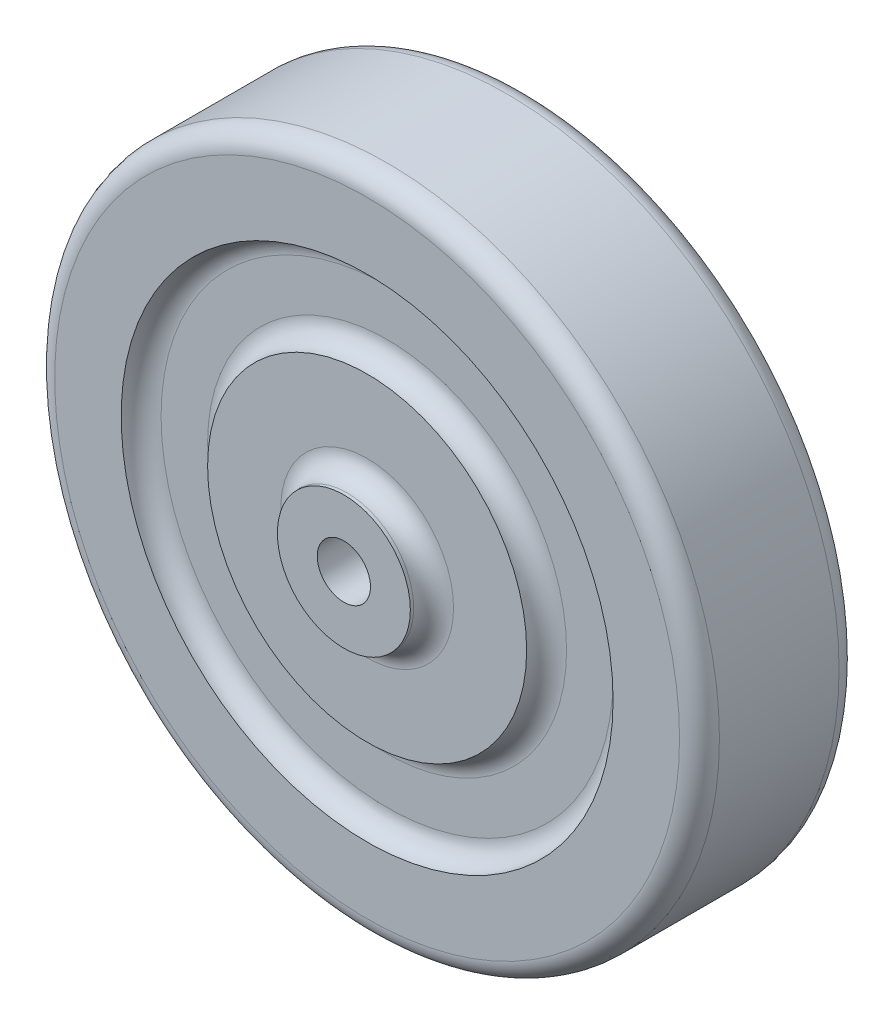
SolidWorks part; units mm, degrees
ref_plane "正面" through (0, 0, 0) normal (0, 0, 1) x (1, 0, 0)
ref_plane "平面" through (0, 0, 0) normal (0, 1, 0) x (1, 0, 0)
ref_plane "右側面" through (0, 0, 0) normal (1, 0, 0) x (0, 0, -1)
sketch "ｽｹｯﾁ2" plane through (0, 0, 0) normal (0, 0, 1) x (1, 0, 0)
  circle A0 centre (0, 0) radius 50
  dimension "D1" = 100
extrude "押し出し1" add sketch "ｽｹｯﾁ2" along normal mid plane 24
sketch "ｽｹｯﾁ4" plane through (0, 0, 12) normal (0, 0, 1) x (1, 0, 0)
  circle A0 centre (0, 0) radius 10
  dimension "D1" = 20
extrude "押し出し2" add sketch "ｽｹｯﾁ4" along normal blind 3.5
sketch "ｽｹｯﾁ5" plane through (0, 0, -12) normal (0, 0, -1) x (-1, 0, 0)
  circle A0 centre (0, 0) radius 10
  dimension "D1" = 20
extrude "押し出し3" add sketch "ｽｹｯﾁ5" along normal blind 3.5
sketch "ｽｹｯﾁ6" plane through (0, 0, 15.5) normal (0, 0, 1) x (1, 0, 0)
  circle A0 centre (0, 0) radius 4
  dimension "D1" = 8
extrude "押し出し4" cut sketch "ｽｹｯﾁ6" against normal through all
sketch "ｽｹｯﾁ7" plane through (0, 0, 12) normal (0, 0, 1) x (1, 0, 0)
  circle A0 centre (0, 0) radius 24
  circle A1 centre (0, 0) radius 37
  dimension "D1" = 48
  dimension "D2" = 74
extrude "押し出し5" cut sketch "ｽｹｯﾁ7" against normal blind 3
sketch "ｽｹｯﾁ8" plane through (0, 0, -12) normal (0, 0, -1) x (-1, 0, 0)
  circle A0 centre (0, 0) radius 24
  circle A1 centre (0, 0) radius 37
  dimension "D1" = 48
  dimension "D2" = 74
extrude "押し出し6" cut sketch "ｽｹｯﾁ8" against normal blind 3
fillet "ﾌｨﾚｯﾄ1" radius 3 2 edges at (50, 0, 12) (50, 0, -12)
fillet "ﾌｨﾚｯﾄ2" radius 3 6 edges at (-37, 0, -9) (37, 0, 9) (24, 0, 9) (-24, 0, -9) (10, 0, -12) (10, 0, 12)
